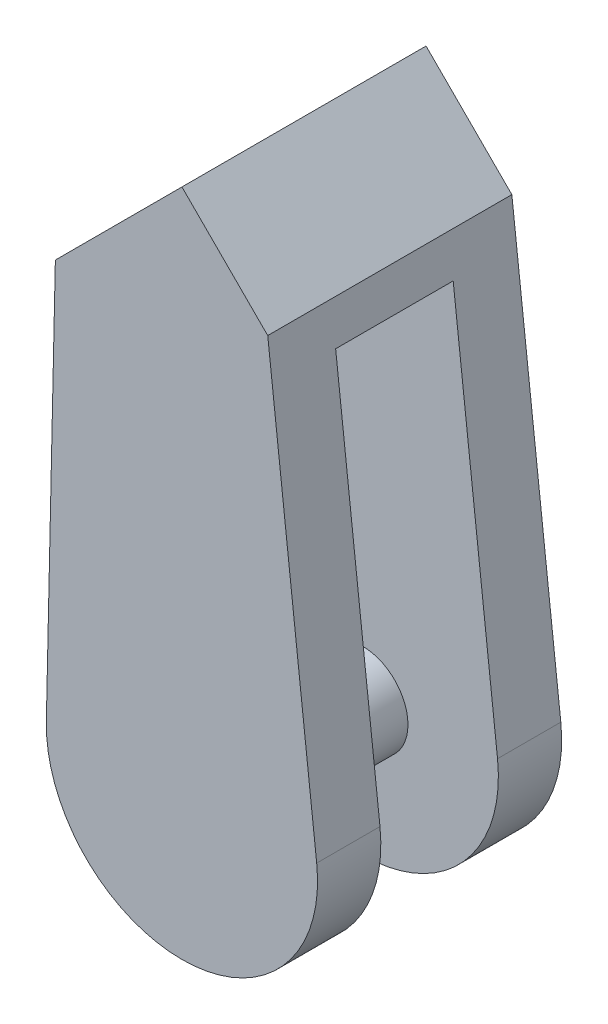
SolidWorks part; units mm, degrees
ref_plane "Plan1" through (0, 0, 0) normal (0, 0, 1) x (1, 0, 0)
ref_plane "Plan2" through (0, 0, 0) normal (0, 1, 0) x (1, 0, 0)
ref_plane "Plan3" through (0, 0, 0) normal (1, 0, 0) x (0, 0, -1)
sketch "Esquisse2" plane through (0, 0, 0) normal (0, 0, 1) x (1, 0, 0)
  line L0 (-1.4, 4.5) -> (-1.4996, 0.0334)
  line L1 (-1.4, 4.5) -> (0, 5.9)
  line L3 (1, 4.5) -> (1.4905, 0.1688)
  line L5 (0, 5.9) -> (0.9489, 4.9511)
  line L6 (1, 4.5) -> (0.9489, 4.9511)
  arc A0 (-1.4996, 0.0334) -> (1.4905, 0.1688) centre (0, 0) ccw
  dimension "D1" = 3
  dimension "D2" = 5.9
  dimension "D3" = 1.4
  dimension "D4" = 1
extrude "Base-Extrusion" add sketch "Esquisse2" along normal mid plane 2.7
sketch "Esquisse3" plane through (0, 0, 0) normal (0, 0, 1) x (1, 0, 0)
  line L1 (-10, 4.5) -> (10, 4.5)
  line L2 (-10, 4.5) -> (-10, -15.5)
  line L3 (-10, -15.5) -> (10, -15.5)
  line L4 (10, 4.5) -> (10, -15.5)
  arc A0 (-1.4996, 0.0334) -> (1.4905, 0.1688) centre (0, 0) ccw construction
  dimension "D1" = 4.5
extrude "Enlèv. mat.-Extru.1" cut sketch "Esquisse3" against normal mid plane 1.3
sketch "Esquisse4" plane through (0, 0, 0) normal (0, 0, 1) x (1, 0, 0)
  circle A0 centre (0, 0) radius 0.5
  dimension "D1" = 1
extrude "Boss.-Extru.1" add sketch "Esquisse4" along normal mid plane 2.7
